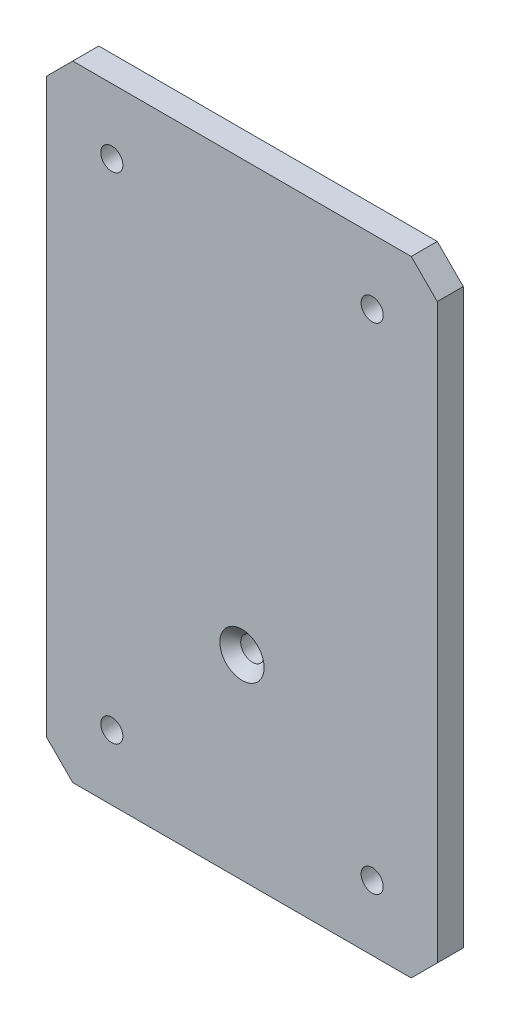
SolidWorks part; units mm, degrees
ref_plane "Plan1" through (0, 0, 0) normal (0, 0, 1) x (1, 0, 0)
ref_plane "Plan2" through (0, 0, 0) normal (0, 1, 0) x (1, 0, 0)
ref_plane "Plan3" through (0, 0, 0) normal (1, 0, 0) x (0, 0, -1)
sketch "Esquisse1" plane through (0, 0, 0) normal (0, 0, 1) x (1, 0, 0)
  line L0 (150, 230) -> (140, 240)
  line L1 (10, 0) -> (140, 0)
  line L2 (0, 10) -> (0, 230)
  line L3 (10, 240) -> (140, 240)
  line L4 (150, 10) -> (150, 230)
  line L5 (0, 230) -> (10, 240)
  line L6 (10, 0) -> (0, 10)
  line L7 (140, 0) -> (150, 10)
  circle A0 centre (25, 215) radius 4.25
  circle A1 centre (125, 215) radius 4.25
  circle A2 centre (25, 25) radius 4.25
  circle A3 centre (125, 25) radius 4.25
  circle A4 centre (75, 75) radius 4.5
  point P0 (0, 0)
  point P1 (150, 240)
  point P2 (0, 240)
  point P3 (150, 0)
  dimension "D3" = 25
  dimension "D4" = 25
  dimension "D9" = 8.5
  dimension "D10" = 8.5
  dimension "D11" = 8.5
  dimension "D12" = 8.5
  dimension "D13" = 190
  dimension "D14" = 100
  dimension "D16" = 75
  dimension "D17" = 9
  dimension "D1" = 150
  dimension "D2" = 240
  dimension "D15" = 75
extrude "Base-Extrusion" add sketch "Esquisse1" along normal blind 10
chamfer "Chanfrein1" distance 4 angle 45
sketch "Esquisse5" plane through (0, 0, 0) normal (0, 0, -1) x (-1, 0, 0)
  point P0 (-76.0534, 129.6434)
